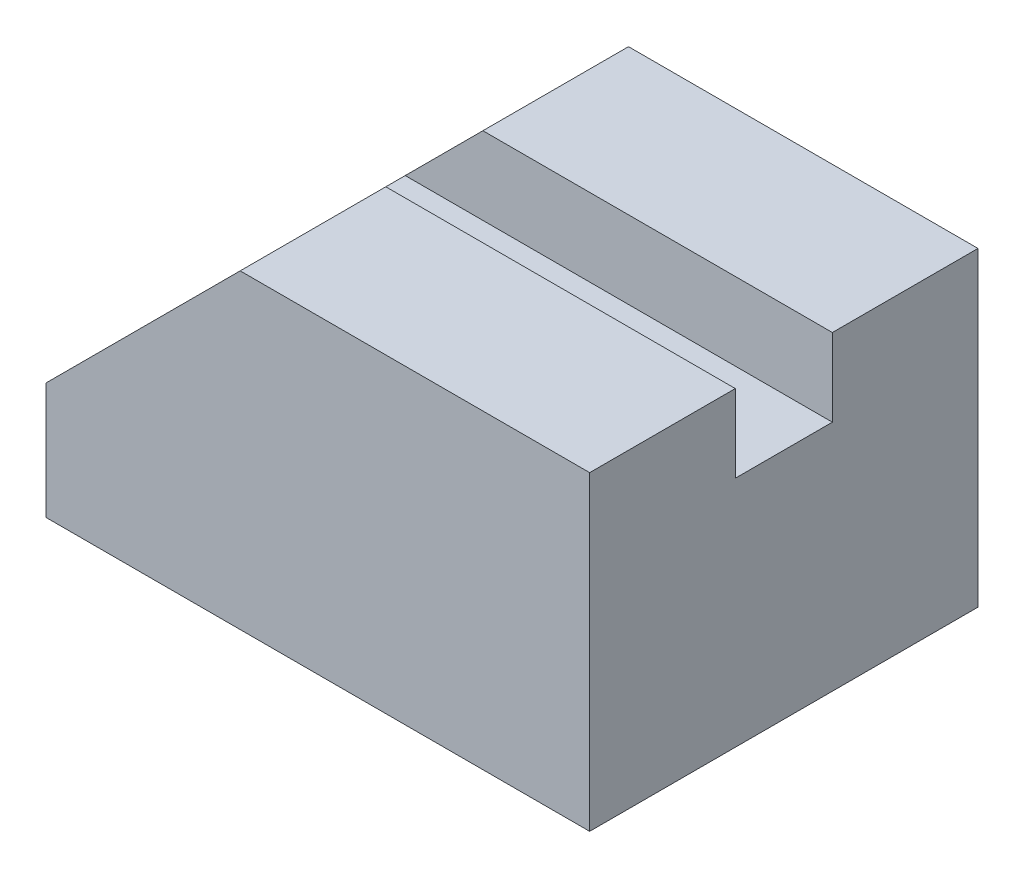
SolidWorks part; units mm, degrees
ref_plane "前视基准面" through (0, 0, 0) normal (0, 0, 1) x (1, 0, 0)
ref_plane "上视基准面" through (0, 0, 0) normal (0, 1, 0) x (1, 0, 0)
ref_plane "右视基准面" through (0, 0, 0) normal (1, 0, 0) x (0, 0, -1)
sketch "草图1" plane through (0, 0, 0) normal (1, 0, 0) x (0, 0, -1)
  line L0 (0, 0) -> (0, 53.7009) construction
  line L1 (0, 53.7009) -> (0, 0) construction
  line L2 (0, 0) -> (65.6344, 0) construction
  line L4 (-50, -40) -> (50, -40)
  line L5 (-50, -40) -> (-50, 40)
  line L6 (-50, 40) -> (50, 40)
  line L7 (50, -40) -> (50, 40)
extrude "拉伸1" add sketch "草图1" along normal blind 140
sketch "草图2" plane through (0, 0, 50) normal (0, 0, 1) x (1, 0, 0)
  line L0 (50, 40) -> (0, -10)
  line L3 (0, 40) -> (50.0005, 40.0064)
  line L4 (0, -10) -> (0, 40)
  line L5 (50, 40) -> (50.0005, 40.0064)
extrude "切除-拉伸1" cut sketch "草图2" against normal up to next
sketch "草图3" plane through (140, 0, 0) normal (1, 0, 0) x (0, 0, -1)
  line L0 (0, 0) -> (0, 56.1677) construction
  line L1 (50, 40) -> (-50, 40) construction
  line L2 (-12.5, 50.7018) -> (12.5, 50.7018)
  line L3 (-12.5, 50.7018) -> (-12.5, 20)
  line L4 (-12.5, 20) -> (12.5, 20)
  line L5 (12.5, 50.7018) -> (12.5, 20)
  dimension "D1" = 20
extrude "切除-拉伸2" cut sketch "草图3" against normal up to next
